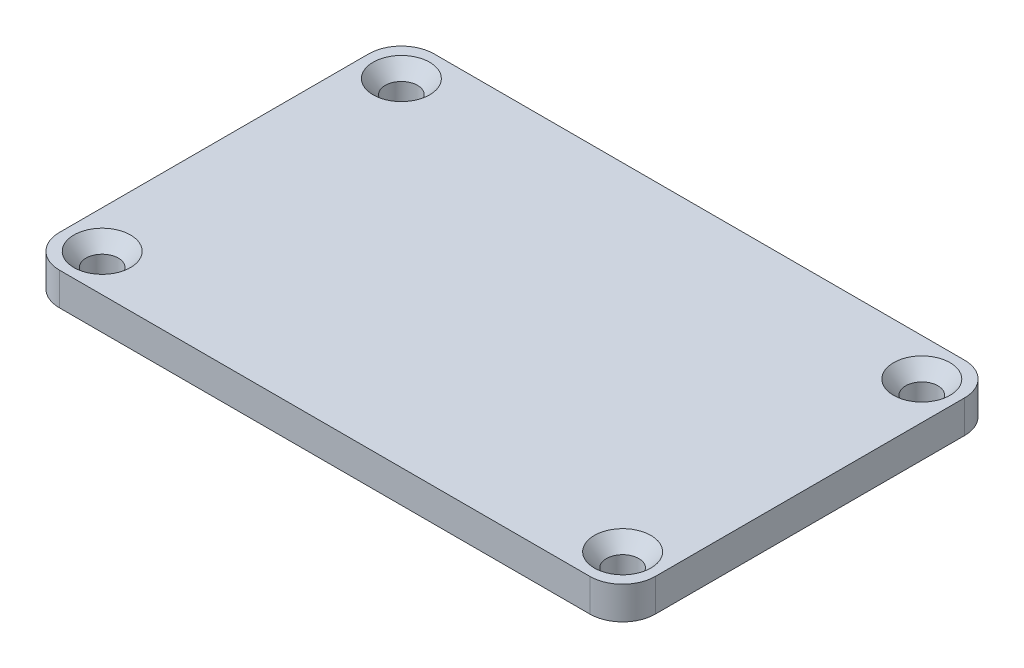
SolidWorks part; units mm, degrees
ref_plane "Front Plane" through (0, 0, 0) normal (0, 0, 1) x (1, 0, 0)
ref_plane "Top Plane" through (0, 0, 0) normal (0, 1, 0) x (1, 0, 0)
ref_plane "Right Plane" through (0, 0, 0) normal (1, 0, 0) x (0, 0, -1)
sketch "Sketch1" plane through (0, 0, 0) normal (0, 1, 0) x (1, 0, 0)
  line L1 (-30.099, -18.923) -> (30.099, -18.923)
  line L2 (-30.099, -18.923) -> (-30.099, 18.923)
  line L3 (-30.099, 18.923) -> (30.099, 18.923)
  line L4 (30.099, -18.923) -> (30.099, 18.923)
  line L5 (-30.099, -18.923) -> (30.099, 18.923) construction
  line L6 (-30.099, 18.923) -> (30.099, -18.923) construction
  point P0 (0, 0)
  dimension "D1" = 60.198
  dimension "D2" = 37.846
extrude "Boss-Extrude1" add sketch "Sketch1" along normal blind 3.302 contours L2 L1 L4 L3
fillet "Fillet2" radius 3.302 4 edges at (-30.099, 1.651, -18.923) (-30.099, 1.651, 18.923) (30.099, 1.651, 18.923) (30.099, 1.651, -18.923)
hole_wizard "CSK for #4 Flat Head Machine Screw1" positions "Sketch6" profile "Sketch7" countersink size "#4" standard "ANSI Inch"
sketch "Sketch6" plane through (0, 3.302, 0) normal (0, 1, 0) x (1, 0, 0)
  line L0 (0, 18.923) -> (0, -26.682) construction
  line L1 (-26.797, 18.923) -> (26.797, 18.923) construction
  line L3 (-30.099, 0) -> (37.1965, 0) construction
  line L4 (-30.099, -15.621) -> (-30.099, 15.621) construction
  point P0 (-26.289, 15.113)
  point P2 (26.289, 15.113)
  point P4 (26.289, -15.113)
  point P6 (-26.289, -15.113)
  dimension "D1" = 52.578
  dimension "D2" = 30.226
sketch "Sketch7" plane through (-26.289, 3.302, -15.113) normal (1, 0, 0) x (0, 0, 1)
  line L0 (0, 0) -> (0, 3.302)
  line L1 (0, 3.302) -> (1.6319, 3.302)
  line L2 (1.6319, 3.302) -> (1.6319, 1.4098)
  line L3 (1.6319, 1.4098) -> (2.8575, 0)
  line L5 (2.8575, 0) -> (0, 0)
  line L6 (-1.6319, 1.4098) -> (-2.8575, 0) construction
  line L11 (0, -6.35) -> (0, 107.95) construction
  dimension "Thru Hole Dia." = 3.2639
  dimension "Thru Hole Depth" = 3.302
  dimension "Near C'Sink Dia." = 5.715
  dimension "Near C'Sink Angle" = 82
